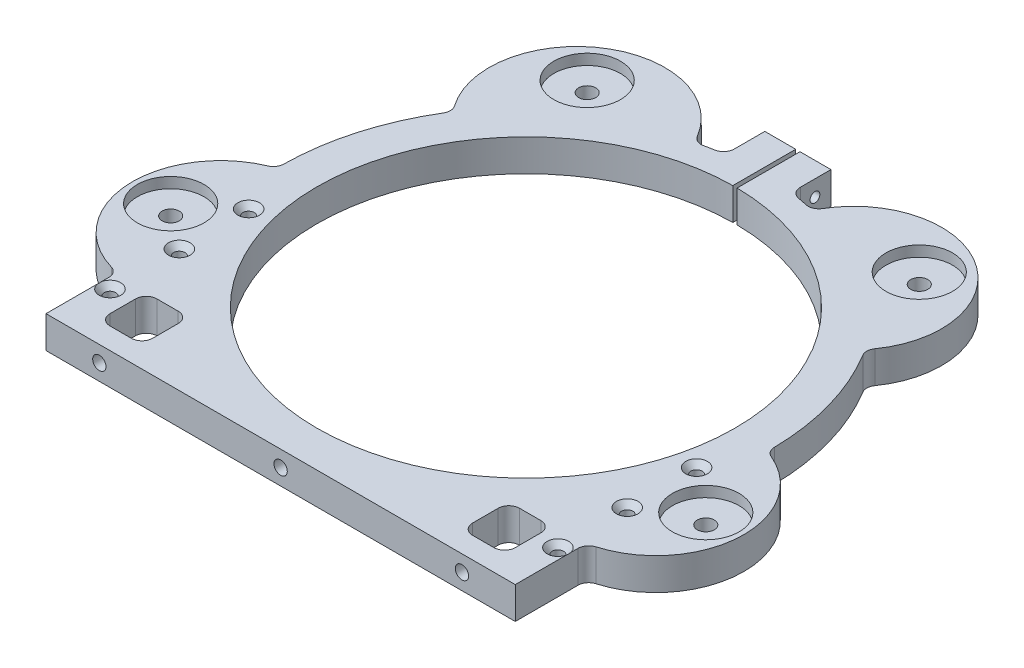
SolidWorks part; units mm, degrees
ref_plane "Front" through (0, 0, 0) normal (0, 0, 1) x (1, 0, 0)
ref_plane "Top" through (0, 0, 0) normal (0, 1, 0) x (1, 0, 0)
ref_plane "Right" through (0, 0, 0) normal (1, 0, 0) x (0, 0, -1)
sketch "Sketch1" plane through (0, 0, 0) normal (0, 1, 0) x (1, 0, 0)
  line L0 (139.7, -108.652) -> (139.7, -146.05)
  line L1 (-129.5767, -52.2109) -> (200.3457, -52.2109) construction
  line L2 (-139.7, -146.05) -> (-139.7, -108.652)
  line L3 (-179.5047, 0) -> (124.46, 0) construction
  line L4 (0, 211.105) -> (0, -289.2455) construction
  line L5 (134.5364, 0) -> (214.831, 0) construction
  line L12 (0, 0) -> (-82.4073, 112.8057) construction
  line L13 (139.7, -146.05) -> (-139.7, -146.05)
  line L14 (-159.2613, -52.2109) -> (-302.2818, -52.2109) construction
  circle A0 centre (0, 0) radius 124.46
  arc A1 (-139.6409, 4.0634) -> (-120.6308, 70.4577) centre (0, 0) cw
  arc A2 (144.2709, -102.5563) -> (144.2157, -1.8495) centre (129.5767, -52.2109) ccw
  arc A3 (144.2709, -102.5563) -> (139.7, -108.652) centre (146.05, -108.652) ccw
  arc A4 (144.2157, -1.8495) -> (139.6409, 4.0634) centre (145.9882, 4.2481) cw
  arc A5 (-144.2157, -1.8495) -> (-139.6409, 4.0634) centre (-145.9882, 4.2481) ccw
  arc A6 (-144.2709, -102.5563) -> (-139.7, -108.652) centre (-146.05, -108.652) cw
  arc A7 (-144.2709, -102.5563) -> (-144.2157, -1.8495) centre (-129.5767, -52.2109) cw
  arc A8 (-30.442, 136.3429) -> (30.442, 136.3429) centre (0, 0) cw
  arc A13 (121.3839, 77.8968) -> (120.6308, 70.4577) centre (126.1141, 73.6603) ccw
  arc A14 (37.3, 139.3222) -> (30.442, 136.3429) centre (31.8258, 142.5403) cw
  arc A15 (-121.3839, 77.8968) -> (-37.3, 139.3222) centre (-82.4073, 112.8057) cw
  arc A17 (121.3839, 77.8968) -> (37.3, 139.3222) centre (82.4073, 112.8057) ccw
  arc A18 (120.6308, 70.4577) -> (139.6409, 4.0634) centre (0, 0) cw
  circle A19 centre (-98.8659, 135.3354) radius 5.08
  circle A20 centre (98.8659, 135.3354) radius 5.08
  circle A21 centre (-159.3022, -52.2109) radius 5.08
  circle A22 centre (159.3022, -52.2109) radius 5.08
  arc A23 (-121.3839, 77.8968) -> (-120.6308, 70.4577) centre (-126.1141, 73.6603) cw
  arc A24 (-37.3, 139.3222) -> (-30.442, 136.3429) centre (-31.8258, 142.5403) ccw
  point P47 (118.1304, 74.574)
  point P66 (35.1237, 135.2125)
  point P69 (-118.1304, 74.574)
  point P72 (-35.1237, 135.2125)
  dimension "D2" = 139.7
  dimension "D3" = 6.35
  dimension "D4" = 6.35
  dimension "D5" = 248.92
  dimension "D6" = 167.64
  dimension "D9" = 6.35
  dimension "D10" = 146.05
  dimension "D11" = 52.446
  dimension "D12" = 52.324
  dimension "D13" = 10.16
  dimension "D15" = 167.6011
  dimension "D18" = 139.7
extrude "Base-Extrude" add sketch "Sketch1" along normal blind 19.05
sketch "Sketch3" [suppressed] plane through (0, 19.05, 0) normal (0, 1, 0) x (-1, 0, 0)
  line L0 (-139.7, 146.05) -> (-139.7, 105.7188) construction
  line L1 (-139.7, 120.0702) -> (-139.7, 0)
  line L2 (0, -189.3118) -> (0, 255.9144) construction
  line L3 (-139.7, 120.0702) -> (-202.9393, 120.0702)
  line L4 (24.341, -137.5631) -> (24.341, -157.4932)
  line L5 (-202.9393, -181.7982) -> (-202.9393, 120.0702)
  line L6 (202.9393, -181.7982) -> (202.9393, 120.0702)
  line L8 (139.7, 120.0702) -> (202.9393, 120.0702)
  line L9 (139.7, 120.0702) -> (139.7, 0)
  line L10 (-24.341, -137.5631) -> (-24.341, -157.4932)
  line L11 (-24.341, -181.7982) -> (-202.9393, -181.7982)
  line L13 (-24.341, -157.4932) -> (-24.341, -181.7982)
  line L14 (24.341, -157.4932) -> (24.341, -181.7982)
  line L15 (24.341, -181.7982) -> (202.9393, -181.7982)
  arc A0 (-30.442, -136.3429) -> (30.442, -136.3429) centre (0, 0) ccw construction
  arc A1 (-139.7, 0) -> (-24.341, -137.5631) centre (0, 0) ccw
  arc A2 (139.7, 0) -> (24.341, -137.5631) centre (0, 0) cw
extrude "Cut-Extrude2" [suppressed] cut sketch "Sketch3" against normal through all
sketch "Sketch4" plane through (0, 19.05, 0) normal (0, 1, 0) x (-1, 0, 0)
  arc A0 (-146.0301, 2.4127) -> (-122.6245, -79.3337) centre (0, 0) ccw
  arc A1 (-146.0301, 2.4127) -> (-132.9214, -0.1283) centre (-129.5767, 52.2109) ccw
  arc A2 (-112.8439, -70.245) -> (-122.6245, -79.3337) centre (-82.4073, -112.8057) ccw
  arc A4 (132.9214, -0.1283) -> (146.0301, 2.4127) centre (129.5767, 52.2109) ccw
  arc A5 (122.6245, -79.3337) -> (146.0301, 2.4127) centre (0, 0) ccw
  arc A7 (-132.9214, -0.1283) -> (-112.8439, -70.245) centre (0, 0) ccw
  arc A8 (112.8439, -70.245) -> (132.9214, -0.1283) centre (0, 0) ccw
  arc A11 (122.6245, -79.3337) -> (112.8439, -70.245) centre (82.4073, -112.8057) ccw
  dimension "D1" = 292.1
extrude "Extrude2" add sketch "Sketch4" against normal up to surface (19.05 mm away)
hole_wizard ",250 -CounterSunk1" positions "Sketch31" profile "Sketch21" legacy
sketch "Sketch31" plane through (-154.8295, 19.05, 82.7036) normal (0, 1, 0) x (-1, 0, 0)
  point P0 (-21.4795, -9.6786)
sketch "Sketch21" plane through (-133.35, 19.05, 73.025) normal (1, 0, 0) x (0, 0, 1)
  line L0 (0, 0) -> (0, 100)
  line L1 (0, 100) -> (3.3782, 100)
  line L2 (3.3782, 100) -> (3.3782, 3.5209)
  line L3 (3.3782, 3.5209) -> (6.4389, 0)
  line L4 (6.4389, 0) -> (0, 0)
  line L5 (0, -6.4453) -> (0, 115.525) construction
  line L6 (-3.3782, 3.5209) -> (-6.4389, 0) construction
  dimension "Diameter" = 6.7564
  dimension "Depth" = 100
  dimension "C-Sink Angle" = 82
  dimension "C-Sink Diameter" = 12.8778
hole_wizard ",250 -CounterSunk2" positions "Sketch32" profile "Sketch22" legacy
sketch "Sketch32" plane through (98.1719, 19.05, 90.8123) normal (0, 1, 0) x (-1, 0, 0)
  point P0 (-35.1781, -17.7873)
sketch "Sketch22" plane through (133.35, 19.05, 73.025) normal (1, 0, 0) x (0, 0, 1)
  line L0 (0, 0) -> (0, 100)
  line L1 (0, 100) -> (3.3782, 100)
  line L2 (3.3782, 100) -> (3.3782, 3.5209)
  line L3 (3.3782, 3.5209) -> (6.4389, 0)
  line L4 (6.4389, 0) -> (0, 0)
  line L5 (0, -6.4453) -> (0, 115.525) construction
  line L6 (-3.3782, 3.5209) -> (-6.4389, 0) construction
  dimension "Diameter" = 6.7564
  dimension "Depth" = 100
  dimension "C-Sink Angle" = 82
  dimension "C-Sink Diameter" = 12.8778
hole_wizard ",250 -CounterSunk3" positions "Sketch33" profile "Sketch23" legacy
sketch "Sketch33" plane through (107.1764, 19.05, 112.0168) normal (0, 1, 0) x (-1, 0, 0)
  point P0 (-26.1736, 2.2832)
sketch "Sketch23" plane through (133.35, 19.05, 114.3) normal (1, 0, 0) x (0, 0, 1)
  line L0 (0, 0) -> (0, 100)
  line L1 (0, 100) -> (3.3782, 100)
  line L2 (3.3782, 100) -> (3.3782, 3.5209)
  line L3 (3.3782, 3.5209) -> (6.4389, 0)
  line L4 (6.4389, 0) -> (0, 0)
  line L5 (0, -6.4453) -> (0, 115.525) construction
  line L6 (-3.3782, 3.5209) -> (-6.4389, 0) construction
  dimension "Diameter" = 6.7564
  dimension "Depth" = 100
  dimension "C-Sink Angle" = 82
  dimension "C-Sink Diameter" = 12.8778
hole_wizard ",250 -CounterSunk4" positions "Sketch34" profile "Sketch24" legacy
sketch "Sketch34" plane through (-157.6768, 19.05, 115.7405) normal (0, 1, 0) x (-1, 0, 0)
  point P1 (-24.3268, -1.4405)
sketch "Sketch24" plane through (-133.35, 19.05, 114.3) normal (1, 0, 0) x (0, 0, 1)
  line L0 (0, 0) -> (0, 100)
  line L1 (0, 100) -> (3.3782, 100)
  line L2 (3.3782, 100) -> (3.3782, 3.5209)
  line L3 (3.3782, 3.5209) -> (6.4389, 0)
  line L4 (6.4389, 0) -> (0, 0)
  line L5 (0, -6.4453) -> (0, 115.525) construction
  line L6 (-3.3782, 3.5209) -> (-6.4389, 0) construction
  dimension "Diameter" = 6.7564
  dimension "Depth" = 100
  dimension "C-Sink Angle" = 82
  dimension "C-Sink Diameter" = 12.8778
hole_wizard ",250 -CounterSunk5" positions "Sketch35" profile "Sketch25" legacy
sketch "Sketch35" plane through (108.1074, 19.05, 32.8866) normal (0, 1, 0) x (-1, 0, 0)
  point P1 (-25.2426, -1.1366)
sketch "Sketch25" plane through (133.35, 19.05, 31.75) normal (1, 0, 0) x (0, 0, 1)
  line L0 (0, 0) -> (0, 100)
  line L1 (0, 100) -> (3.3782, 100)
  line L2 (3.3782, 100) -> (3.3782, 3.5209)
  line L3 (3.3782, 3.5209) -> (6.4389, 0)
  line L4 (6.4389, 0) -> (0, 0)
  line L5 (0, -6.4453) -> (0, 115.525) construction
  line L6 (-3.3782, 3.5209) -> (-6.4389, 0) construction
  dimension "Diameter" = 6.7564
  dimension "Depth" = 100
  dimension "C-Sink Angle" = 82
  dimension "C-Sink Diameter" = 12.8778
hole_wizard ",250 -CounterSunk6" positions "Sketch36" profile "Sketch26" legacy
sketch "Sketch36" plane through (-160.9351, 19.05, 34.283) normal (0, 1, 0) x (-1, 0, 0)
  point P0 (-27.5851, -2.533)
sketch "Sketch26" plane through (-133.35, 19.05, 31.75) normal (1, 0, 0) x (0, 0, 1)
  line L0 (0, 0) -> (0, 100)
  line L1 (0, 100) -> (3.3782, 100)
  line L2 (3.3782, 100) -> (3.3782, 3.5209)
  line L3 (3.3782, 3.5209) -> (6.4389, 0)
  line L4 (6.4389, 0) -> (0, 0)
  line L5 (0, -6.4453) -> (0, 115.525) construction
  line L6 (-3.3782, 3.5209) -> (-6.4389, 0) construction
  dimension "Diameter" = 6.7564
  dimension "Depth" = 100
  dimension "C-Sink Angle" = 82
  dimension "C-Sink Diameter" = 12.8778
fillet "Fillet1" radius 6.35
sketch "Sketch36" plane through (0, 19.05, 0) normal (0, 1, 0) x (-1, 0, 0)
  line L0 (139.7, 146.05) -> (-139.7, 146.05) construction
  line L1 (-114.3, 105.4217) -> (-101.6, 105.4217)
  line L2 (-120.65, 111.7717) -> (-120.65, 127)
  line L3 (-114.3, 133.35) -> (-101.6, 133.35)
  line L4 (-95.25, 111.7717) -> (-95.25, 127)
  line L5 (-139.7, 146.05) -> (-139.7, 115.3663) construction
  line L6 (0, 0) -> (0, 58.9678) construction
  line L7 (95.25, 111.7717) -> (95.25, 127)
  line L8 (114.3, 133.35) -> (101.6, 133.35)
  line L9 (120.65, 111.7717) -> (120.65, 127)
  line L10 (114.3, 105.4217) -> (101.6, 105.4217)
  arc A0 (-101.6, 105.4217) -> (-95.25, 111.7717) centre (-101.6, 111.7717) ccw
  arc A1 (-114.3, 105.4217) -> (-120.65, 111.7717) centre (-114.3, 111.7717) cw
  arc A2 (-120.65, 127) -> (-114.3, 133.35) centre (-114.3, 127) cw
  arc A3 (-101.6, 133.35) -> (-95.25, 127) centre (-101.6, 127) cw
  arc A5 (101.6, 133.35) -> (95.25, 127) centre (101.6, 127) ccw
  arc A6 (120.65, 127) -> (114.3, 133.35) centre (114.3, 127) ccw
  arc A7 (114.3, 105.4217) -> (120.65, 111.7717) centre (114.3, 111.7717) ccw
  arc A8 (101.6, 105.4217) -> (95.25, 111.7717) centre (101.6, 111.7717) cw
  point P10 (-95.25, 105.4217)
  point P13 (-120.65, 105.4217)
  point P18 (-95.25, 133.35)
  dimension "D5" = 6.35
  dimension "D1" = 27.9283
  dimension "D2" = 25.4
  dimension "D3" = 12.7
  dimension "D4" = 19.05
extrude "Cut-Extrude3" cut sketch "Sketch36" against normal through all
sketch "Sketch37" plane through (0, 0, 146.05) normal (0, 0, 1) x (1, 0, 0)
  line L0 (0, 0) -> (0, -27.956) construction
  line L1 (0, 0) -> (0, 24.3418) construction
  line L2 (139.7, 19.05) -> (139.7, 0) construction
  line L3 (-65.3496, 9.525) -> (196.3866, 9.525) construction
  line L5 (-139.7, 0) -> (139.7, 0) construction
  circle A0 centre (107.95, 9.525) radius 3.9624
  circle A1 centre (-107.95, 9.525) radius 3.9624
  circle A2 centre (0, 9.525) radius 3.9624
  dimension "D1" = 7.9248
  dimension "D2" = 31.75
  dimension "D3" = 9.525
extrude "Cut-Extrude4" cut sketch "Sketch37" against normal blind 25.4
sketch "Sketch38" plane through (0, 0, 146.05) normal (0, 0, 1) x (1, 0, 0)
  line L0 (0, 0) -> (0, 34.2573) construction
  line L2 (-139.7, 0) -> (139.7, 0) construction
  circle A0 centre (0, 9.525) radius 3.9624
  dimension "D1" = 7.9248
  dimension "D2" = 9.525
extrude "Cut-Extrude5" [suppressed] cut sketch "Sketch38" against normal blind 33.02
sketch "Sketch39" [suppressed] plane through (0, 19.05, 0) normal (0, 1, 0) x (-1, 0, 0)
  line L0 (0, 0) -> (0, 170.9122) construction
  line L1 (0, 124.3969) -> (0, 146.05) construction
  line L2 (139.7, 146.05) -> (-139.7, 146.05) construction
  line L3 (-107.95, 107.95) -> (-95.25, 107.95)
  line L4 (-114.3, 114.3) -> (-114.3, 127)
  line L5 (-107.95, 133.35) -> (-95.25, 133.35)
  line L6 (-88.9, 114.3) -> (-88.9, 127)
  line L7 (-139.7, 113.2337) -> (-139.7, 74.0913) construction
  line L8 (88.9, 114.3) -> (88.9, 127)
  line L9 (107.95, 133.35) -> (95.25, 133.35)
  line L10 (114.3, 114.3) -> (114.3, 127)
  line L11 (107.95, 107.95) -> (95.25, 107.95)
  arc A0 (-95.25, 133.35) -> (-88.9, 127) centre (-95.25, 127) cw
  arc A1 (-114.3, 127) -> (-107.95, 133.35) centre (-107.95, 127) cw
  arc A2 (-107.95, 107.95) -> (-114.3, 114.3) centre (-107.95, 114.3) cw
  arc A3 (-95.25, 107.95) -> (-88.9, 114.3) centre (-95.25, 114.3) ccw
  arc A4 (95.25, 107.95) -> (88.9, 114.3) centre (95.25, 114.3) cw
  arc A5 (107.95, 107.95) -> (114.3, 114.3) centre (107.95, 114.3) ccw
  arc A6 (114.3, 127) -> (107.95, 133.35) centre (107.95, 127) ccw
  arc A7 (95.25, 133.35) -> (88.9, 127) centre (95.25, 127) ccw
  point P14 (-88.9, 133.35)
  point P19 (-114.3, 107.95)
  point P22 (-88.9, 107.95)
  dimension "D5" = 6.35
  dimension "D1" = 25.4
  dimension "D2" = 25.4
  dimension "D3" = 12.7
  dimension "D4" = 25.4
extrude "Cut-Extrude6" [suppressed] cut sketch "Sketch39" against normal through all
sketch "Sketch40" [suppressed] plane through (0, 0, 146.05) normal (0, 0, 1) x (1, 0, 0)
  line L0 (139.8161, 9.525) -> (68.0495, 9.525) construction
  line L2 (139.7, 19.05) -> (139.7, 0) construction
  line L3 (0, 0) -> (0, -21.7835) construction
  circle A0 centre (101.6, 9.525) radius 3.9624
  circle A1 centre (-101.6, 9.525) radius 3.9624
  dimension "D1" = 7.9248
  dimension "D2" = 38.1
extrude "Cut-Extrude7" [suppressed] cut sketch "Sketch40" against normal blind 25.4
sketch "Sketch42"
  line L0 (-0.635, -128.9043) -> (-0.635, -161.925)
  line L2 (0.635, -128.9021) -> (0.635, -161.925)
  line L3 (19.685, -128.9021) -> (19.685, -161.925)
  line L4 (0, 0) -> (0, -170.8581) construction
  line L5 (-19.685, -129.0694) -> (-19.685, -161.925)
  line L6 (19.685, -161.925) -> (0.635, -161.925)
  line L8 (-0.635, -161.925) -> (-19.685, -161.925)
  line L9 (0, 0) -> (0, -159.668) construction
  line L10 (-19.685, -129.0694) -> (-0.635, -128.9043)
  line L11 (0.635, -128.9021) -> (19.685, -128.9021)
  dimension "D1" = 161.925
  dimension "D2" = 0.635
  dimension "D4" = 19.05
extrude "Cut-Extrude8" cut sketch "Sketch41" against normal through all
sketch "Sketch41" plane through (0, 19.05, 0) normal (0, 1, 0) x (-1, 0, 0)
  line L0 (0, 0) -> (0, -167.5379) construction
  line L1 (0, 0) -> (0, -165.3617) construction
  line L2 (1.27, -167.5379) -> (1.27, -121.5744)
  line L3 (1.27, -121.5744) -> (-1.27, -121.5744)
  line L4 (-1.27, -121.5744) -> (-1.27, -167.5379)
  line L5 (-1.27, -167.5379) -> (1.27, -167.5379)
  line L6 (19.685, -161.925) -> (19.685, -138.3061) construction
  line L7 (-19.685, -138.3061) -> (-19.685, -161.925) construction
  dimension "D1" = 18.415
  dimension "D2" = 2.54
  dimension "D3" = 18.415
extrude "Extrude3" add sketch "Sketch42" against normal up to surface (19.05 mm away)
sketch "Sketch44" plane through (19.685, 0, -68.1908) normal (1, 0, 0) x (0, 0, -1)
  line L2 (14.4419, 0) -> (96.9389, 0) construction
  circle A1 centre (84.2092, 9.525) radius 2.921
  dimension "D1" = 5.842
  dimension "D4" = 9.525
extrude "Cut-Extrude10" cut sketch "Sketch44" against normal through all
fillet "Fillet2" radius 6.35
sketch "Sketch45" [suppressed] plane through (0, 19.05, 0) normal (0, 1, 0) x (-1, 0, 0)
  line L0 (0, 0) -> (-195.6466, 0) construction
  line L1 (0, 0) -> (-193.6498, -111.8038) construction
  line L2 (-113.9217, -67.2392) -> (-139.5962, -82.0624)
  line L3 (-115.1917, -65.0395) -> (-140.8662, -79.8626)
  line L4 (-147.2162, -68.8641) -> (-140.8662, -79.8626)
  line L5 (-107.5717, -78.2377) -> (-133.2462, -93.0609)
  line L6 (-121.5417, -54.041) -> (-147.2162, -68.8641)
  line L7 (-121.5417, -54.041) -> (-115.1917, -65.0395)
  line L8 (-139.5962, -82.0624) -> (-133.2462, -93.0609)
  line L9 (-113.9217, -67.2392) -> (-107.5717, -78.2377)
  dimension "D1" = 30
  dimension "D2" = 1.27
  dimension "D3" = 1.27
  dimension "D4" = 12.7
  dimension "D5" = 12.7
  dimension "D6" = 161.925
extrude "Extrude4" [suppressed] add sketch "Sketch45" against normal up to surface (19.05 mm away)
fillet "Fillet3" [suppressed] radius 6.35
sketch "Sketch46" [suppressed] plane through (0, 19.05, 0) normal (0, 1, 0) x (-1, 0, 0)
  line L0 (-121.6137, -68.7473) -> (-99.7712, -56.1364)
  line L1 (-140.8662, -79.8626) -> (-121.6137, -68.7473) construction
  line L2 (-120.3437, -70.947) -> (-98.5012, -58.3361)
  line L3 (-120.3437, -70.947) -> (-139.5962, -82.0624) construction
  line L4 (-121.6137, -68.7473) -> (-125.4237, -70.947)
  line L5 (-99.7712, -56.1364) -> (-98.5012, -58.3361)
  line L6 (-120.3437, -70.947) -> (-124.3524, -73.2614)
  line L7 (-124.3524, -73.2614) -> (-125.4237, -70.947)
extrude "Cut-Extrude12" [suppressed] cut sketch "Sketch46" against normal through all
sketch "Sketch47" [suppressed] plane through (-6.985, 0, -12.0984) normal (-0.5, 0, -0.866) x (-0.866, 0, 0.5)
  line L0 (-161.925, 0) -> (-161.925, 19.05) construction
  line L1 (-161.925, 0) -> (-144.6295, 0) construction
  circle A0 centre (-153.9748, 9.525) radius 2.921
  dimension "D1" = 5.842
  dimension "D2" = 7.9502
  dimension "D3" = 9.525
extrude "Cut-Extrude13" [suppressed] cut sketch "Sketch47" against normal through all
sketch "Sketch49" plane through (0, 19.05, 0) normal (0, 1, 0) x (-1, 0, 0)
  circle A0 centre (98.8659, -135.3354) radius 19.8438
  circle A1 centre (159.3022, 52.2109) radius 19.8438
  circle A2 centre (-98.8659, -135.3354) radius 19.8438
  circle A3 centre (-159.3022, 52.2109) radius 19.8438
  dimension "D1" = 39.6875
extrude "Cut-Extrude14" cut sketch "Sketch49" against normal blind 6.35
sketch "Sketch50" plane through (0, 0, 0) normal (0, -1, 0) x (1, 0, 0)
  circle A0 centre (159.3022, 52.2109) radius 11.1125
  circle A1 centre (98.8659, -135.3354) radius 11.1125
  circle A2 centre (-98.8659, -135.3354) radius 11.1125
  circle A3 centre (-159.3022, 52.2109) radius 11.1125
  dimension "D1" = 22.225
extrude "Cut-Extrude15" cut sketch "Sketch50" against normal blind 5.08
